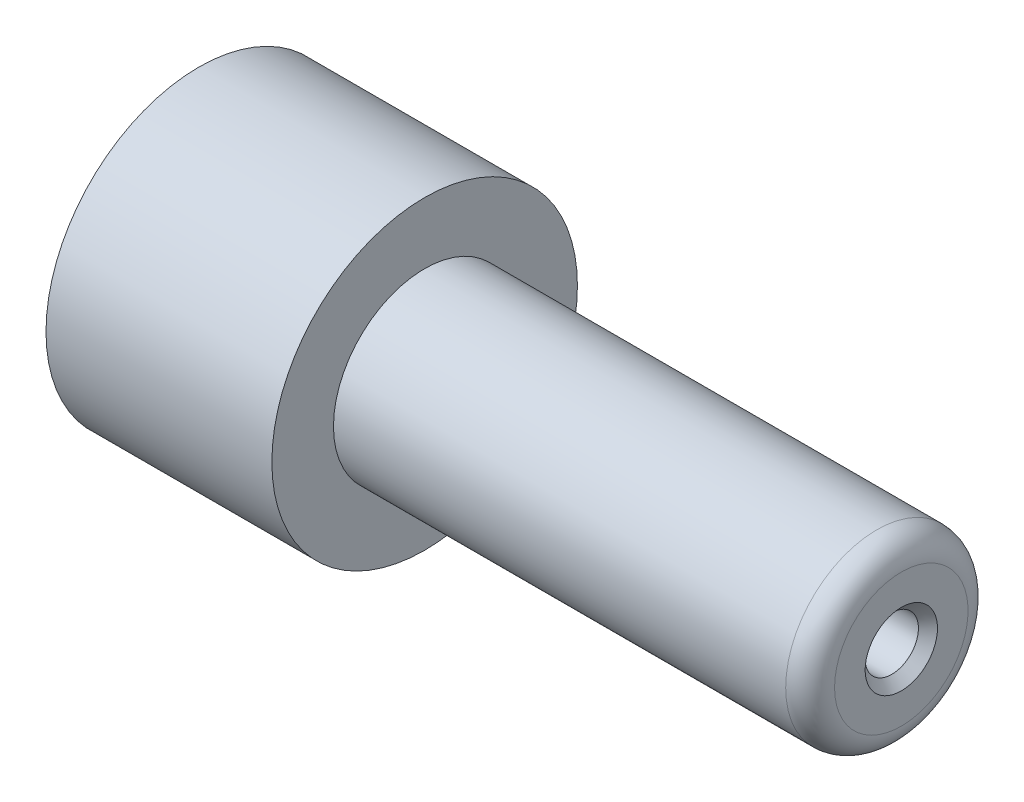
SolidWorks part; units mm, degrees
ref_plane "Front Plane" through (0, 0, 0) normal (0, 0, 1) x (1, 0, 0)
ref_plane "Top Plane" through (0, 0, 0) normal (0, 1, 0) x (1, 0, 0)
ref_plane "Right Plane" through (0, 0, 0) normal (1, 0, 0) x (0, 0, -1)
sketch "Sketch1" plane through (0, 0, 0) normal (0, 0, 1) x (1, 0, 0)
  line L0 (0, 0) -> (102.3864, 0) construction
  line L1 (0, 3.5687) -> (0, 7.9375)
  line L2 (0, 7.9375) -> (11.7348, 7.9375)
  line L3 (11.7348, 7.9375) -> (11.7348, 4.7371)
  line L4 (11.7348, 4.7371) -> (35.2298, 4.7371)
  line L5 (36.4998, 3.4671) -> (36.4998, 0)
  line L6 (36.4998, 0) -> (24.4856, 0)
  line L7 (0, 3.5687) -> (24.4856, 3.5687)
  line L8 (24.4856, 3.5687) -> (24.4856, 0)
  arc A0 (36.4998, 3.4671) -> (35.2298, 4.7371) centre (35.2298, 3.4671) ccw
  dimension "D5" = 1.27
  dimension "D1" = 11.7348
  dimension "D2" = 7.9375
  dimension "D3" = 24.4856
  dimension "D4" = 3.5687
  dimension "D6" = 24.765
  dimension "D7" = 4.7371
revolve "Revolve1" add sketch "Sketch1" angle 360 about L0
sketch "Sketch2" plane through (0, 0, 0) normal (-1, 0, 0) x (0, 0, 1)
  line L0 (0, 0) -> (9.7644, 0) construction
  circle A0 centre (0, 5.5499) radius 1.1811
  circle A1 centre (0, -5.5499) radius 1.1811
  dimension "D2" = 2.3622
  dimension "D1" = 11.0998
extrude "Cut-Extrude1" cut sketch "Sketch2" against normal blind 2.3876
sketch "Sketch3" plane through (36.4998, 0, 0) normal (1, 0, 0) x (0, 0, -1)
  circle A0 centre (0, 0) radius 1.3843
  dimension "D1" = 2.7686
extrude "Cut-Extrude2" cut sketch "Sketch3" against normal blind 9.525
chamfer "Chamfer1" distance 0.4953 angle 45 1 edges at (36.4998, 0, -1.3843)
